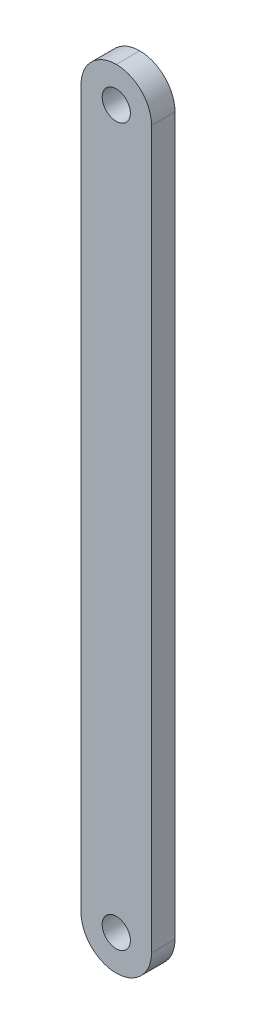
SolidWorks part; units mm, degrees
ref_plane "Plan de face" through (0, 0, 0) normal (0, 0, 1) x (1, 0, 0)
ref_plane "Plan de dessus" through (0, 0, 0) normal (0, 1, 0) x (1, 0, 0)
ref_plane "Plan de droite" through (0, 0, 0) normal (1, 0, 0) x (0, 0, -1)
sketch "Esquisse1" plane through (0, 0, 0) normal (0, 0, 1) x (1, 0, 0)
  line L0 (-15, 335) -> (-15, 0)
  line L1 (-15, 0) -> (15, 0)
  line L2 (15, 0) -> (15, 335)
  line L3 (15, 335) -> (-15, 335)
  circle A0 centre (0, 320) radius 6
  circle A1 centre (0, 15) radius 6
  dimension "D3" = 12
  dimension "D4" = 15
  dimension "D5" = 15
  dimension "D6" = 12
  dimension "D7" = 15
  dimension "D8" = 15
  dimension "D1" = 335
  dimension "D2" = 30
extrude "Extrusion1" add sketch "Esquisse1" along normal blind 10
fillet "Congé1" radius 15 4 edges at (-15, 335, 5) (15, 335, 5) (-15, 0, 5) (15, 0, 5)
